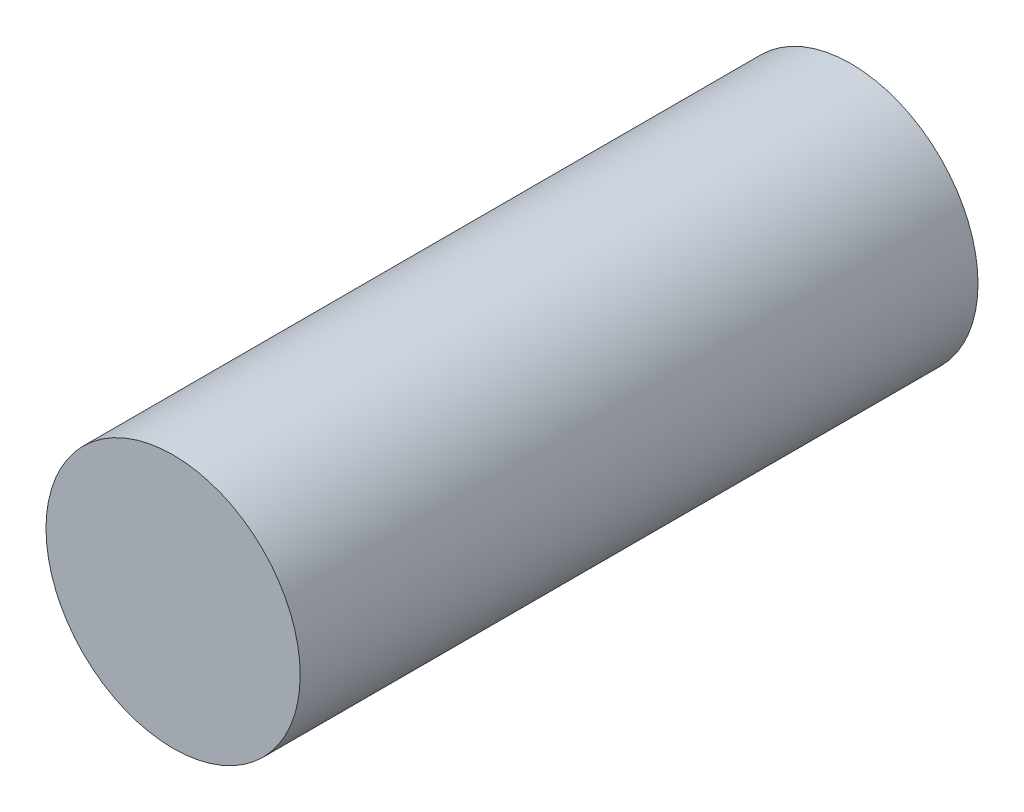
SolidWorks part; units mm, degrees
ref_plane "front" through (0, 0, 0) normal (0, 0, 1) x (1, 0, 0)
ref_plane "top" through (0, 0, 0) normal (0, 1, 0) x (1, 0, 0)
ref_plane "side" through (0, 0, 0) normal (1, 0, 0) x (0, 0, -1)
sketch "Sketch1"
  dimension "D1" = 19.05
extrude "Base-Extrude" add sketch "Sketch1" along normal blind 50.8
